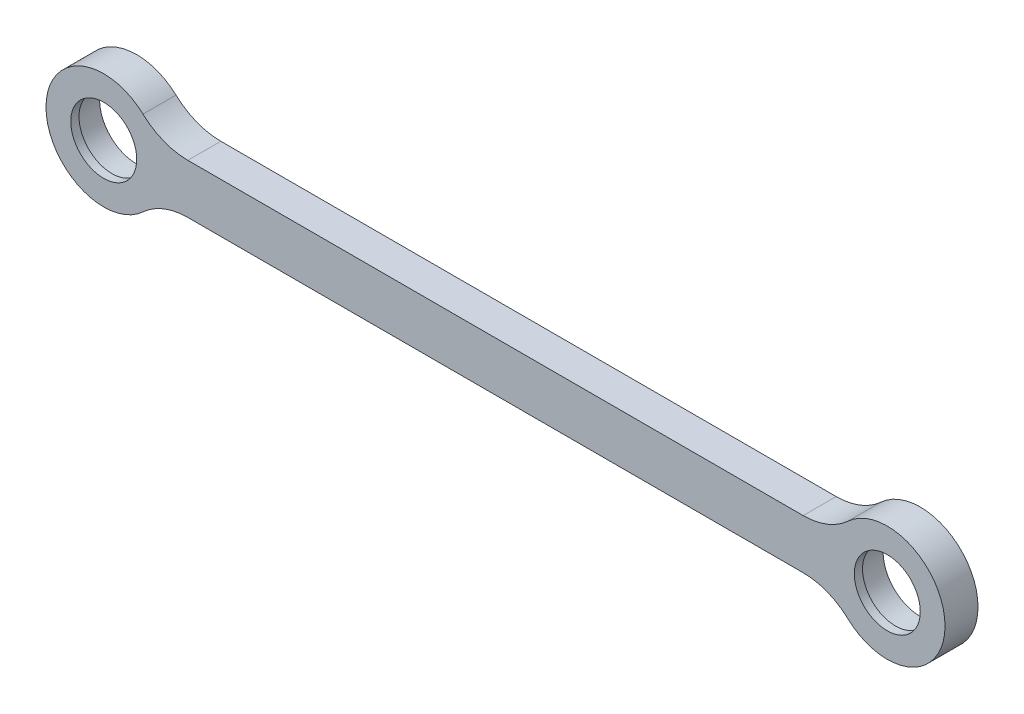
SolidWorks part; units mm, degrees
ref_plane "前视基准面" through (0, 0, 0) normal (0, 0, 1) x (1, 0, 0)
ref_plane "上视基准面" through (0, 0, 0) normal (0, 1, 0) x (1, 0, 0)
ref_plane "右视基准面" through (0, 0, 0) normal (1, 0, 0) x (0, 0, -1)
sketch "草图1" plane through (0, 0, 0) normal (0, 0, 1) x (1, 0, 0)
  line L0 (0, 0) -> (95, 0) construction
  line L1 (6.3246, 3) -> (88.6754, 3)
  line L2 (6.3246, -3) -> (88.6754, -3)
  circle A0 centre (0, 0) radius 2.1
  arc A1 (6.3246, 3) -> (6.3246, -3) centre (0, 0) ccw
  circle A2 centre (95, 0) radius 2.1
  arc A3 (88.6754, -3) -> (88.6754, 3) centre (95, 0) ccw
  dimension "D1" = 4.2
  dimension "D2" = 14
  dimension "D3" = 95
  dimension "D4" = 3
extrude "凸台-拉伸1" add sketch "草图1" along normal blind 4
fillet "圆角1" radius 8 4 edges at (88.6754, 3, 2) (88.6754, -3, 2) (6.3246, -3, 2) (6.3246, 3, 2)
sketch "草图2" plane through (0, 0, 4) normal (0, 0, 1) x (1, 0, 0)
  circle A0 centre (0, 0) radius 4.5
  circle A1 centre (95, 0) radius 4.5
  dimension "D1" = 9
extrude "切除-拉伸1" cut sketch "草图2" against normal blind 4
sketch "草图3" plane through (0, 0, 4) normal (0, 0, 1) x (1, 0, 0)
  circle A0 centre (0, 0) radius 4
  circle A1 centre (95, 0) radius 4
  circle A2 centre (95, 0) radius 4.5 construction
  circle A3 centre (0, 0) radius 4.5 construction
  circle A4 centre (95, 0) radius 4.5
  circle A5 centre (0, 0) radius 4.5
  dimension "D1" = 8
  dimension "D2" = 8
extrude "凸台-拉伸2" add sketch "草图3" against normal blind 1
